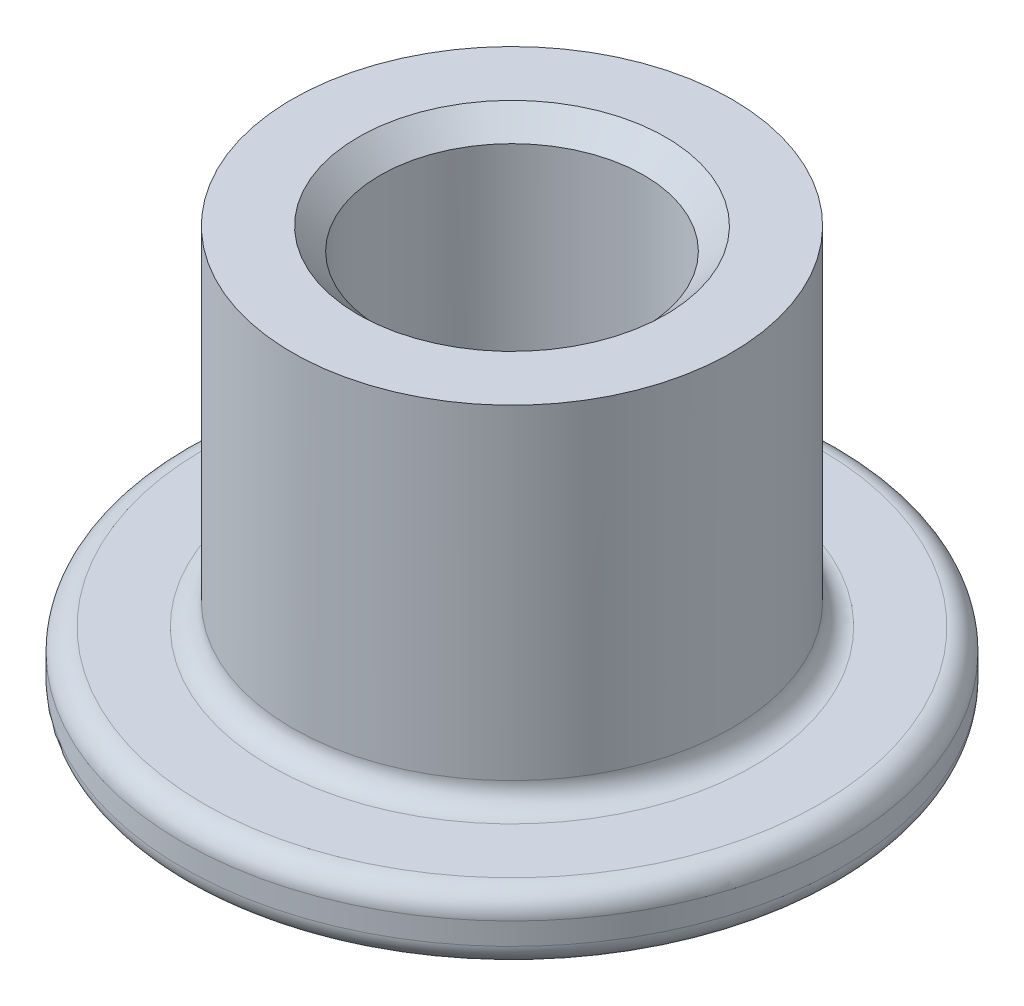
SolidWorks part; units mm, degrees
ref_plane "Plan de face" through (0, 0, 0) normal (0, 0, 1) x (1, 0, 0)
ref_plane "Plan de dessus" through (0, 0, 0) normal (0, 1, 0) x (1, 0, 0)
ref_plane "Plan de droite" through (0, 0, 0) normal (1, 0, 0) x (0, 0, -1)
sketch "Esquisse1" plane through (0, 0, 0) normal (0, 0, 1) x (1, 0, 0)
  line L0 (0, -18.2966) -> (0, 54.8898) construction
  line L1 (3, 0) -> (7.5, 0)
  line L2 (7.5, 0) -> (7.5, 1.5)
  line L3 (7.5, 1.5) -> (5, 1.5)
  line L4 (5, 1.5) -> (5, 9.4)
  line L5 (5, 9.4) -> (3, 9.4)
  line L6 (3, 9.4) -> (3, 0)
  dimension "D1" = 3
  dimension "D2" = 7.5
  dimension "D3" = 5
  dimension "D4" = 1.5
  dimension "D5" = 9.4
revolve "Révolution1" add sketch "Esquisse1" angle 360 about L0
chamfer "Chanfrein1" distance 0.5 angle 45 2 edges at (0, 0, -3) (0, 9.4, -3)
fillet "Congé1" radius 0.5 3 edges at (0, 1.5, -5) (0, 0, -7.5) (0, 1.5, -7.5)
